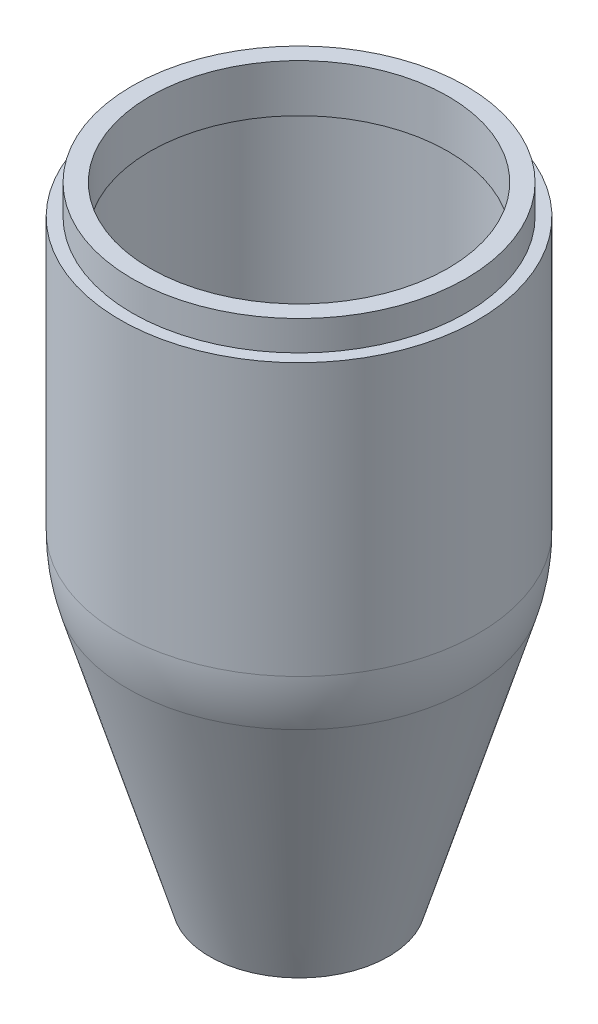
SolidWorks part; units mm, degrees
ref_plane "Front" through (0, 0, 0) normal (0, 0, 1) x (1, 0, 0)
ref_plane "Top" through (0, 0, 0) normal (0, 1, 0) x (1, 0, 0)
ref_plane "Right" through (0, 0, 0) normal (1, 0, 0) x (0, 0, -1)
sketch "Sketch1" plane through (0, 0, 0) normal (0, 0, 1) x (1, 0, 0)
  line L0 (0, 0) -> (0, 100)
  line L1 (0, 100) -> (30, 100)
  line L2 (30, 100) -> (30, 54.4031)
  line L3 (28.7348, 45.7826) -> (15, 0)
  line L4 (15, 0) -> (0, 0)
  arc A0 (30, 54.4031) -> (28.7348, 45.7826) centre (0, 54.4031) cw
  point P8 (30, 50)
  dimension "D5" = 30
  dimension "D1" = 100
  dimension "D2" = 30
  dimension "D3" = 50
  dimension "D4" = 15
revolve "Revolve1" add sketch "Sketch1" angle 360 about L0
sketch "Sketch2" plane through (0, 100, 0) normal (0, 1, 0) x (1, 0, 0)
  circle A2 centre (0, 0) radius 28
  circle A3 centre (0, 0) radius 28
  dimension "D1" = 2
extrude "Extrude-Thin1" add sketch "Sketch2" along normal blind 5 thin
shell "Shell1" thickness 3
